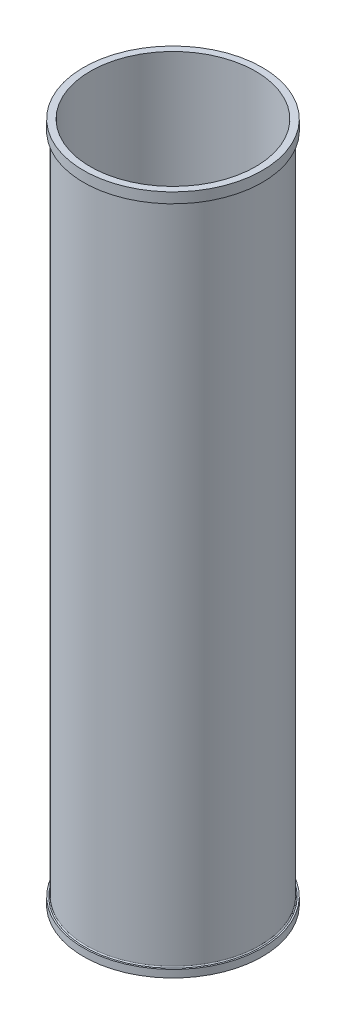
SolidWorks part; units mm, degrees
ref_plane "Front Plane" through (0, 0, 0) normal (0, 0, 1) x (1, 0, 0)
ref_plane "Top Plane" through (0, 0, 0) normal (0, 1, 0) x (1, 0, 0)
ref_plane "Right Plane" through (0, 0, 0) normal (1, 0, 0) x (0, 0, -1)
sketch "Sketch1" plane through (0, 0, 0) normal (0, 0, 1) x (1, 0, 0)
  line L0 (0, 0) -> (0, 324.6281) construction
  line L1 (-109.5375, 838.2) -> (-101.3587, 838.2)
  line L3 (-103.3907, 0) -> (-101.3587, 0)
  line L4 (-101.3587, 838.2) -> (-101.3587, 0)
  line L5 (-109.5375, 838.2) -> (-109.5375, 3.5489)
  line L7 (-103.3907, 0) -> (-109.5375, 3.5489)
  line L10 (-103.3907, 0) -> (-119.5862, 0) construction
  dimension "D1" = 202.7174
  dimension "D3" = 30
  dimension "D7" = 2.032
  dimension "D8" = 838.2
revolve "Revolve1" add sketch "Sketch1" angle 360 about L0
sketch "Sketch2" plane through (0, 0, 0) normal (0, 0, 1) x (1, 0, 0)
  line L0 (-109.5375, 825.5) -> (-109.5375, 12.7)
  line L1 (-109.5375, 838.2) -> (-109.5375, 3.5489) construction
  line L2 (-109.5375, 825.5) -> (-107.7087, 825.5)
  line L3 (-106.4387, 824.23) -> (-106.4387, 13.97)
  line L4 (-109.5375, 12.7) -> (-107.7087, 12.7)
  line L6 (-101.3587, 838.2) -> (-101.3587, 0) construction
  line L7 (0, 0) -> (0, 113.1649) construction
  line L8 (0, 0) -> (0, 324.6281) construction
  line L9 (109.5375, 838.2) -> (-109.5375, 838.2) construction
  arc A0 (-107.7087, 825.5) -> (-106.4387, 824.23) centre (-107.7087, 824.23) cw
  arc A1 (-106.4387, 13.97) -> (-107.7087, 12.7) centre (-107.7087, 13.97) cw
  dimension "D1" = 1.27
  dimension "D2" = 12.7
  dimension "D4" = 12.7
  dimension "D5" = 5.08
revolve "Cut-Revolve1" cut sketch "Sketch2" angle 360 about L7
